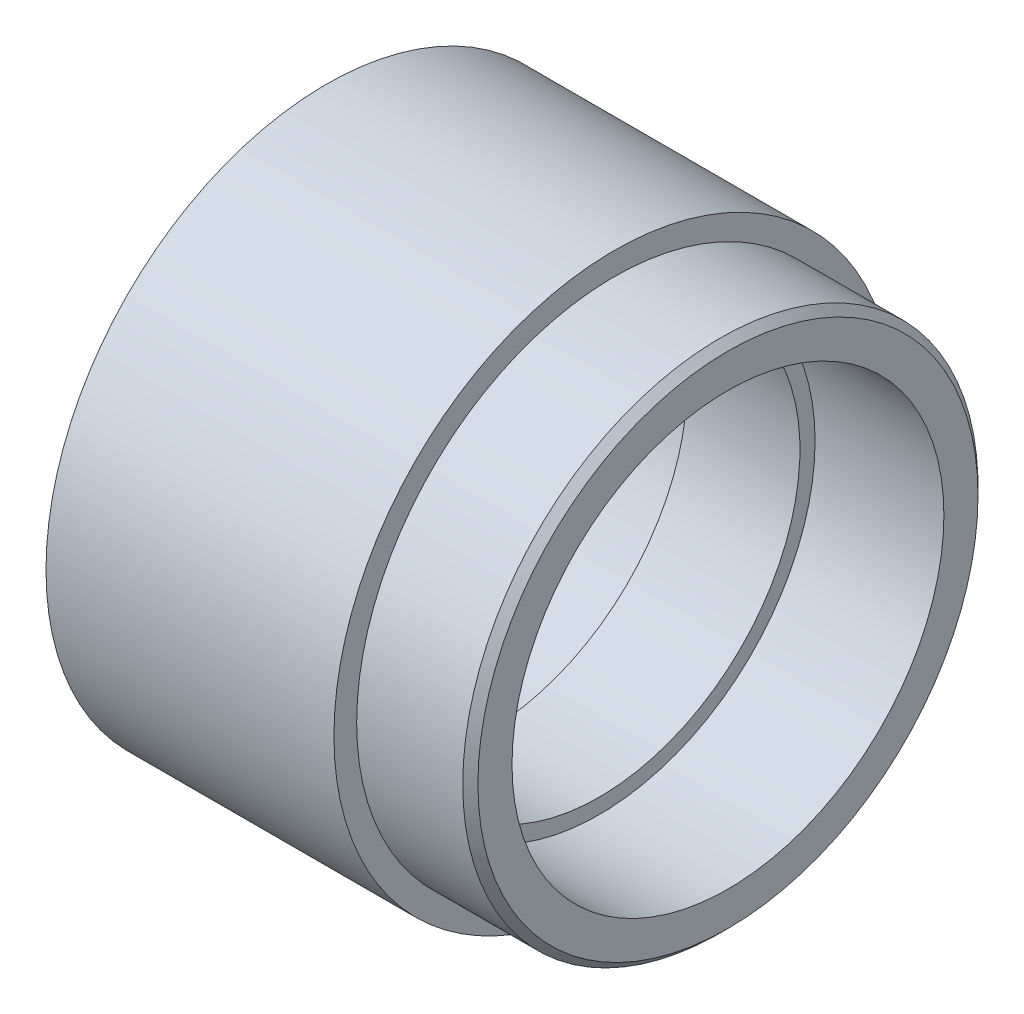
SolidWorks part; units mm, degrees
ref_plane "Plan de face" through (0, 0, 0) normal (0, 0, 1) x (1, 0, 0)
ref_plane "Plan de dessus" through (0, 0, 0) normal (0, 1, 0) x (1, 0, 0)
ref_plane "Plan de droite" through (0, 0, 0) normal (1, 0, 0) x (0, 0, -1)
sketch "Esquisse1" plane through (0, 0, 0) normal (0, 0, 1) x (1, 0, 0)
  line L0 (-8.5068, 0) -> (85.2567, 0) construction
  line L1 (11.1045, 28.5) -> (32.2121, 28.5)
  line L2 (32.2121, 28.5) -> (32.2121, 26.5)
  line L3 (32.2121, 26.5) -> (47.1045, 26.5)
  line L4 (47.1045, 26.5) -> (47.1045, 28.5)
  line L5 (47.1045, 28.5) -> (64.1045, 28.5)
  line L6 (64.1045, 28.5) -> (64.1045, 34)
  line L7 (64.1045, 34) -> (49.1045, 34)
  line L8 (49.1045, 34) -> (49.1045, 37)
  line L9 (49.1045, 37) -> (11.1045, 37)
  line L10 (11.1045, 37) -> (11.1045, 28.5)
  dimension "D1" = 2
  dimension "D2" = 2
  dimension "D3" = 28.5
  dimension "D4" = 37
  dimension "D5" = 38
  dimension "D6" = 15
  dimension "D7" = 17
  dimension "D8" = 34
revolve "Révolution1" add sketch "Esquisse1" angle 360 about L0
chamfer "Chanfrein1" distance 1 angle 45 2 edges at (11.1045, 0, 28.5) (64.1045, 0, 34)
hole_wizard "Trou taraudé M4x0.71" positions "Esquisse3" profile "Esquisse2" tap size "M4x0.7" standard "ISO"
sketch "Esquisse3" plane through (11.1045, 0, 0) normal (-1, 0, 0) x (0, 0, 1)
  point P0 (0, 32.5)
  dimension "D1" = 32.5
sketch "Esquisse2" plane through (11.1045, 32.5, 0) normal (0, 1, 0) x (0, 0, 1)
  line L0 (0, 0) -> (0, 11.0914)
  line L1 (0, 11.0914) -> (1.65, 10.1)
  line L2 (1.65, 10.1) -> (1.65, 8)
  line L3 (1.65, 8) -> (2, 8)
  line L4 (2, 8) -> (2, 0)
  line L5 (2, 0) -> (0, 0)
  line L10 (0, 11.0914) -> (-1.65, 10.1) construction
  line L11 (0, -6.35) -> (0, 107.95) construction
  dimension "Diamètre du trou pour taraudage" = 3.3
  dimension "Profondeur du trou pour taraudage" = 10.1
  dimension "Diamètre principal du filetage" = 4
  dimension "Profondeur du filetage" = 8
  dimension "Angle de pointe" = 118
pattern_circular "Répétition circulaire1" count 4 over 360 about axis through (0, 0, 0) along (1, 0, 0) of "Trou taraudé M4x0.71"
